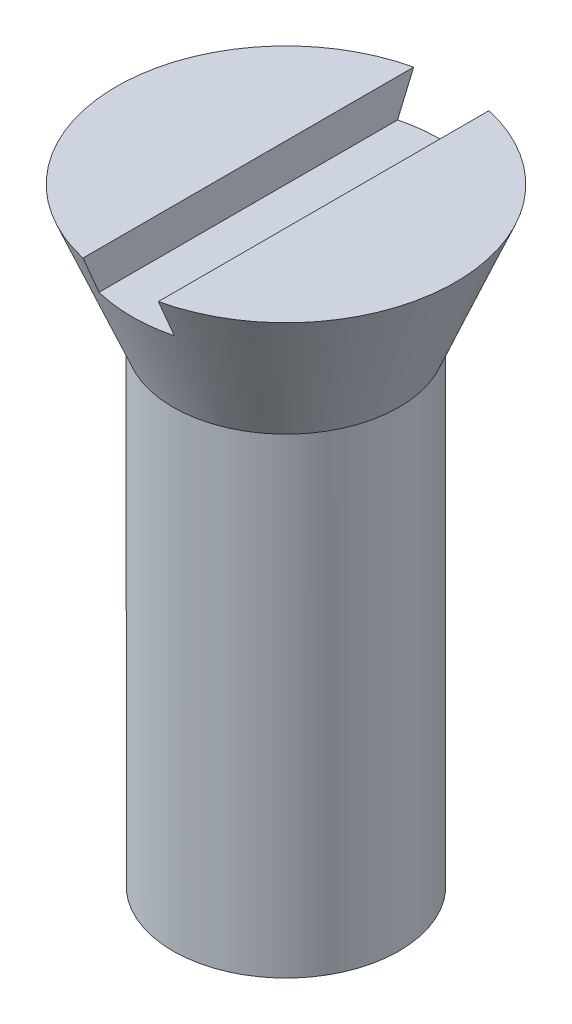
SolidWorks part; units mm, degrees
ref_plane "Front Plane" through (0, 0, 0) normal (0, 0, 1) x (1, 0, 0)
ref_plane "Top Plane" through (0, 0, 0) normal (0, 1, 0) x (1, 0, 0)
ref_plane "Right Plane" through (0, 0, 0) normal (1, 0, 0) x (0, 0, -1)
sketch "Sketch1" plane through (0, 0, 0) normal (0, 0, 1) x (1, 0, 0)
  line L0 (0, 0) -> (0, 24.1895) construction
  line L1 (0, 0) -> (-3, 1.7321)
  line L2 (-3, 1.7321) -> (-3, 14.2321)
  line L3 (-4.5, 17.8534) -> (-3, 14.2321)
  line L4 (-4.5, 17.8534) -> (0, 17.8534)
  line L5 (0, 17.8534) -> (0, 0)
  dimension "D1" = 60
  dimension "D2" = 12.5
  dimension "D3" = 22.5
  dimension "D4" = 6
  dimension "D5" = 9
revolve "Revolve1" add sketch "Sketch1" angle 360 about L0
sketch "Sketch2" plane through (0, 17.8534, 0) normal (0, 1, 0) x (1, 0, 0)
  line L5 (-1, 6.9572) -> (1, 6.9572)
  line L6 (-1, 6.9572) -> (-1, -6.9572)
  line L7 (-1, -6.9572) -> (1, -6.9572)
  line L8 (1, 6.9572) -> (1, -6.9572)
  point P0 (-1, 0)
  point P8 (0, 6.9572)
  dimension "D1" = 2
extrude "Extrude1" cut sketch "Sketch2" against normal blind 1
